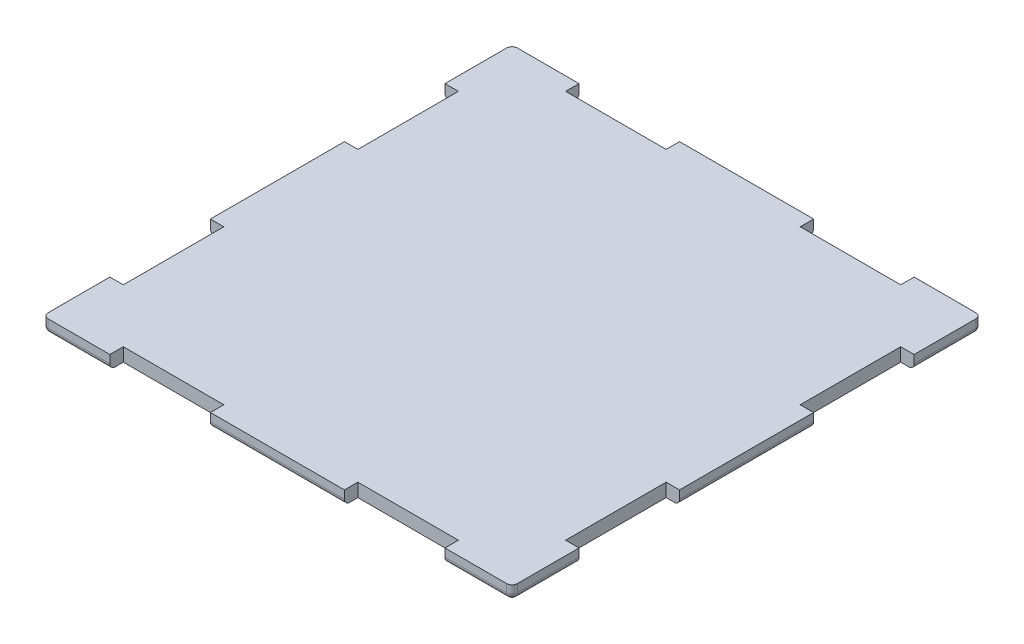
SolidWorks part; units mm, degrees
ref_plane "Front Plane" through (0, 0, 0) normal (0, 0, 1) x (1, 0, 0)
ref_plane "Top Plane" through (0, 0, 0) normal (0, 1, 0) x (1, 0, 0)
ref_plane "Right Plane" through (0, 0, 0) normal (1, 0, 0) x (0, 0, -1)
sketch "Sketch1" plane through (0, 0, 0) normal (0, 1, 0) x (1, 0, 0)
  line L1 (175, -175) -> (-175, -175)
  line L2 (175, -175) -> (175, 175)
  line L3 (175, 175) -> (-175, 175)
  line L4 (-175, -175) -> (-175, 175)
  line L5 (175, -175) -> (-175, 175) construction
  line L6 (175, 175) -> (-175, -175) construction
  point P0 (0, 0)
  dimension "D1" = 350
extrude "Boss-Extrude1" add sketch "Sketch1" along normal blind 10
sketch "Sketch2" plane through (0, 10, 0) normal (0, 1, 0) x (1, 0, 0)
  line L0 (-175, 175) -> (-175, -175) construction
  line L1 (-175, 125) -> (-165, 125)
  line L2 (-175, 125) -> (-175, 50)
  line L3 (-175, 50) -> (-165, 50)
  line L4 (-165, 125) -> (-165, 50)
  line L5 (-175, -175) -> (175, -175) construction
  line L6 (-175, -50) -> (-165, -50)
  line L7 (-175, -50) -> (-175, -125)
  line L8 (-175, -125) -> (-165, -125)
  line L9 (-165, -50) -> (-165, -125)
  line L10 (175, 175) -> (-175, 175) construction
  line L11 (125, 175) -> (125, 165)
  line L12 (125, 175) -> (50, 175)
  line L13 (50, 175) -> (50, 165)
  line L14 (125, 165) -> (50, 165)
  line L15 (-50, 175) -> (-50, 165)
  line L16 (-50, 175) -> (-125, 175)
  line L17 (-125, 175) -> (-125, 165)
  line L18 (-50, 165) -> (-125, 165)
  line L19 (175, -125) -> (165, -125)
  line L20 (175, -125) -> (175, -50)
  line L21 (175, -50) -> (165, -50)
  line L22 (165, -125) -> (165, -50)
  line L23 (175, 50) -> (165, 50)
  line L24 (175, 50) -> (175, 125)
  line L25 (175, 125) -> (165, 125)
  line L26 (165, 50) -> (165, 125)
  line L27 (-125, -175) -> (-125, -165)
  line L28 (-125, -175) -> (-50, -175)
  line L29 (-50, -175) -> (-50, -165)
  line L30 (-125, -165) -> (-50, -165)
  line L31 (50, -175) -> (50, -165)
  line L32 (50, -175) -> (125, -175)
  line L33 (125, -175) -> (125, -165)
  line L34 (50, -165) -> (125, -165)
  point P19 (-165, -50)
  point P22 (-165, 50)
  point P25 (-165, 125)
  point P44 (0, 0)
  dimension "D1" = 50
  dimension "D2" = 75
  dimension "D3" = 75
  dimension "D4" = 50
  dimension "D5" = 10
extrude "Cut-Extrude2" cut sketch "Sketch2" against normal blind 10
fillet "Fillet1" radius 4 16 edges at (175, 0, -150) (175, 0, 0) (175, 0, 150) (175, 5, -175) (150, 0, -175) (0, 0, -175) (-150, 0, -175) (-175, 5, -175) (-175, 0, -150) (-175, 0, 0) (-150, 0, 175) (150, 0, 175) (0, 0, 175) (175, 5, 175) (-175, 5, 175) (-175, 0, 150)
